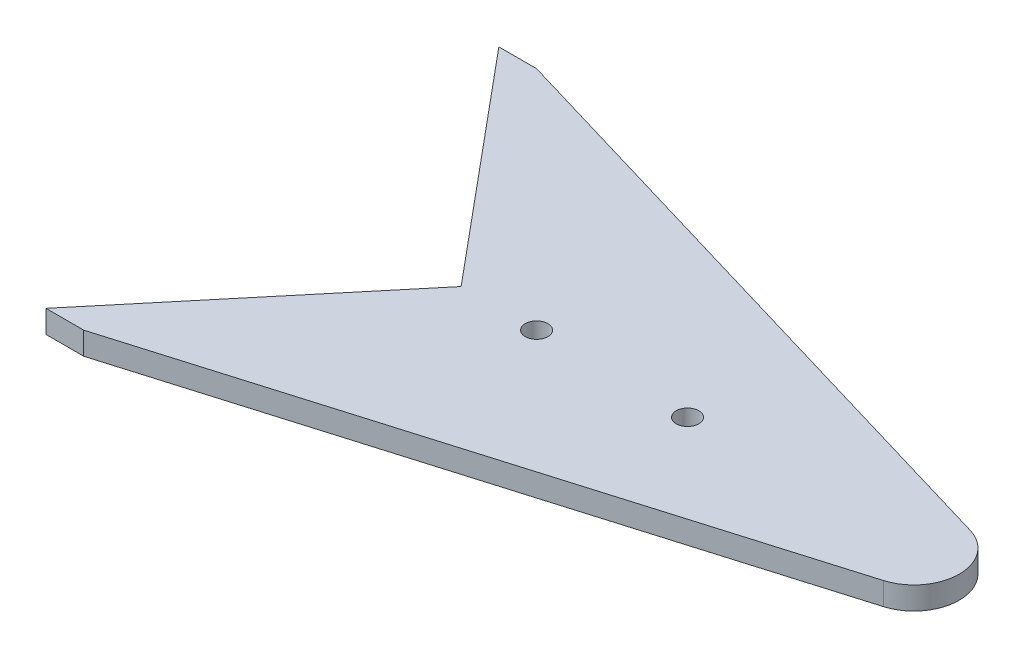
SolidWorks part; units mm, degrees
ref_plane "Front" through (0, 0, 0) normal (0, 0, 1) x (1, 0, 0)
ref_plane "Top" through (0, 0, 0) normal (0, 1, 0) x (1, 0, 0)
ref_plane "Right" through (0, 0, 0) normal (1, 0, 0) x (0, 0, -1)
sketch "Sketch1" plane through (0, 0, 0) normal (0, 1, 0) x (1, 0, 0)
  line L1 (0, 30) -> (5, 30)
  line L2 (0, -30) -> (5, -30)
  line L8 (5, 30) -> (86.7071, 5.7522)
  line L9 (5, -30) -> (86.7071, -5.7522)
  line L10 (0, 30) -> (25, 0)
  line L11 (25, 0) -> (0, -30)
  arc A0 (86.7071, -5.7522) -> (86.7071, 5.7522) centre (85, 0) ccw
  circle A1 centre (35, 0) radius 1.5
  circle A2 centre (55, 0) radius 1.5
extrude "Extrude1" add sketch "Sketch1" along normal blind 3
